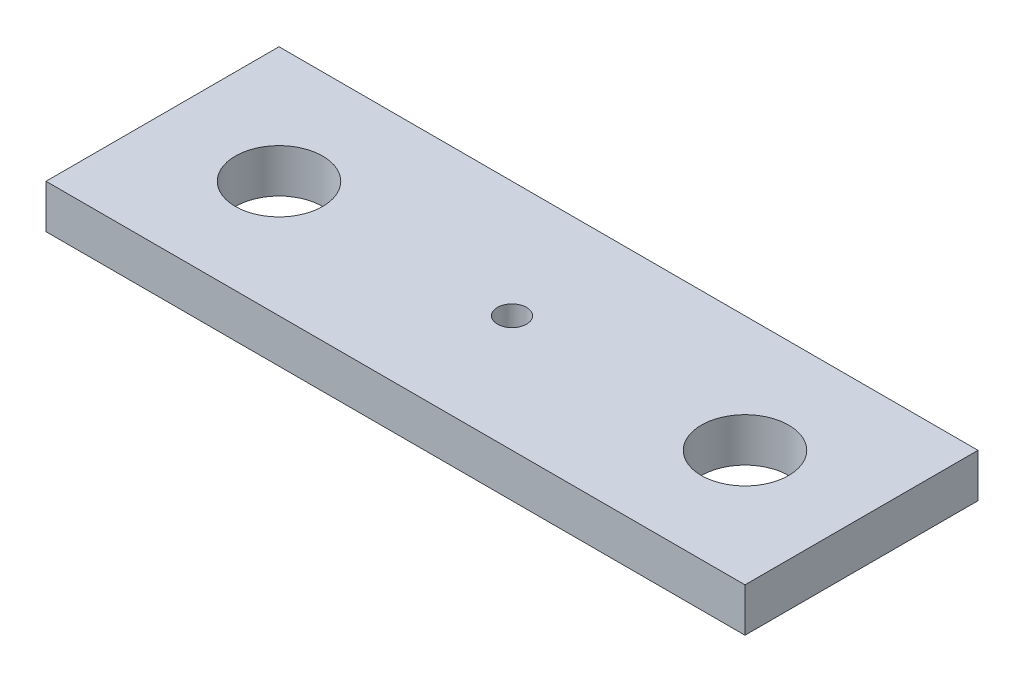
SolidWorks part; units mm, degrees
ref_plane "Front Plane" through (0, 0, 0) normal (0, 0, 1) x (1, 0, 0)
ref_plane "Top Plane" through (0, 0, 0) normal (0, 1, 0) x (1, 0, 0)
ref_plane "Right Plane" through (0, 0, 0) normal (1, 0, 0) x (0, 0, -1)
sketch "Sketch1" plane through (0, 0, 0) normal (0, 1, 0) x (1, 0, 0)
  line L1 (-76.2, 25.4) -> (76.2, 25.4)
  line L2 (-76.2, 25.4) -> (-76.2, -25.4)
  line L3 (-76.2, -25.4) -> (76.2, -25.4)
  line L4 (76.2, 25.4) -> (76.2, -25.4)
  dimension "D1" = 25.4
  dimension "D2" = 50.8
  dimension "D3" = 152.4
  dimension "D4" = 76.2
extrude "Extrude1" add sketch "Sketch1" along normal blind 9.525
sketch "Sketch2" plane through (0, 9.525, 0) normal (0, 1, 0) x (-1, 0, 0)
  line L0 (-76.2, 25.4) -> (-76.2, -25.4) construction
  line L1 (76.2, -25.4) -> (76.2, 25.4) construction
  circle A0 centre (50.8, 0) radius 9.525
  circle A1 centre (-50.8, 0) radius 9.525
  point P6 (76.2, 0)
  dimension "D3" = 19.05
  dimension "D4" = 19.05
  dimension "D1" = 25.4
  dimension "D2" = 25.4
extrude "Cut-Extrude1" cut sketch "Sketch2" against normal through all
sketch "Sketch3" plane through (0, 9.525, 0) normal (0, 1, 0) x (-1, 0, 0)
  circle A0 centre (0, 0) radius 3.175
extrude "Cut-Extrude2" cut sketch "Sketch3" against normal through all
equation "\"D4@Sketch1\" = \"D3@Sketch1\"/2"
equation "\"D1@Sketch1\" = \"D2@Sketch1\"/2"
equation "\"D4@Sketch2\" = \"D3@Sketch2\""
equation "\"D2@Sketch2\" = \"D1@Sketch2\""
